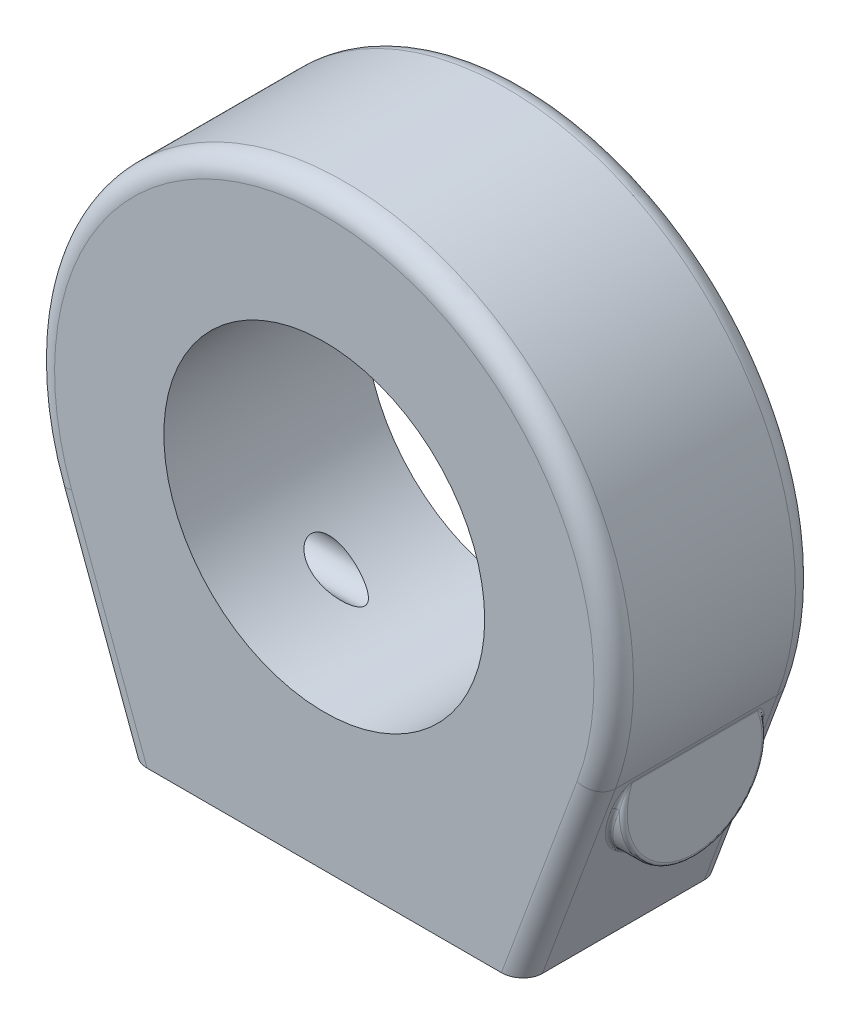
SolidWorks part; units mm, degrees
ref_plane "Front Plane" through (0, 0, 0) normal (0, 0, 1) x (1, 0, 0)
ref_plane "Top Plane" through (0, 0, 0) normal (0, 1, 0) x (1, 0, 0)
ref_plane "Right Plane" through (0, 0, 0) normal (1, 0, 0) x (0, 0, -1)
sketch "Sketch1" plane through (0, 0, 0) normal (0, 0, 1) x (1, 0, 0)
  line L0 (-50, -75) -> (50, -75)
  line L1 (0, 0) -> (0, -75) construction
  line L2 (-50, -75) -> (-68.425, -25.4367)
  line L3 (50, -75) -> (68.425, -25.4367)
  circle A0 centre (0, 0) radius 73
  circle A1 centre (0, 0) radius 40.45
  dimension "D1" = 146
  dimension "D4" = 80.9
  dimension "D2" = 100
  dimension "D3" = 75
extrude "Boss-Extrude1" add sketch "Sketch1" along normal blind 50.8
fillet "Fillet1" radius 5 6 edges at (59.2125, -50.2183, 0) (59.2125, -50.2183, 50.8) (-59.2125, -50.2183, 0) (-59.2125, -50.2183, 50.8) (0, 73, 0) (0, 73, 50.8)
ref_plane "Plane1" through (-68, 0, 0) normal (1, 0, 0) x (0, 0, -1)
sketch "Sketch2" plane through (-68, 0, 0) normal (1, 0, 0) x (0, 0, -1)
  circle A0 centre (-25.4, -33) radius 18
  dimension "D2" = 36
  dimension "D1" = 33
  dimension "D3" = 25.4
extrude "Boss-Extrude2" add sketch "Sketch2" along normal up to next
fillet "Fillet2" radius 1 3 edges at (-68, -26.5798, 25.4) (-58.9219, -51, 25.4) (-68, -51, 25.4)
mirror "Mirror1" about plane through (0, 0, 0) normal (1, 0, 0) of "Boss-Extrude2", "Fillet2"
sketch "Sketch4" plane through (-68, 0, 0) normal (-1, 0, 0) x (0, 0, 1)
  circle A0 centre (25.4, -33) radius 10.5
  dimension "D1" = 21
extrude "Cut-Extrude1" cut sketch "Sketch4" against normal blind 14
sketch "Sketch5" plane through (-54, 0, 0) normal (-1, 0, 0) x (0, 0, 1)
  circle A0 centre (25.4, -33) radius 4.5
  dimension "D1" = 9
extrude "Cut-Extrude2" cut sketch "Sketch5" against normal blind 53
